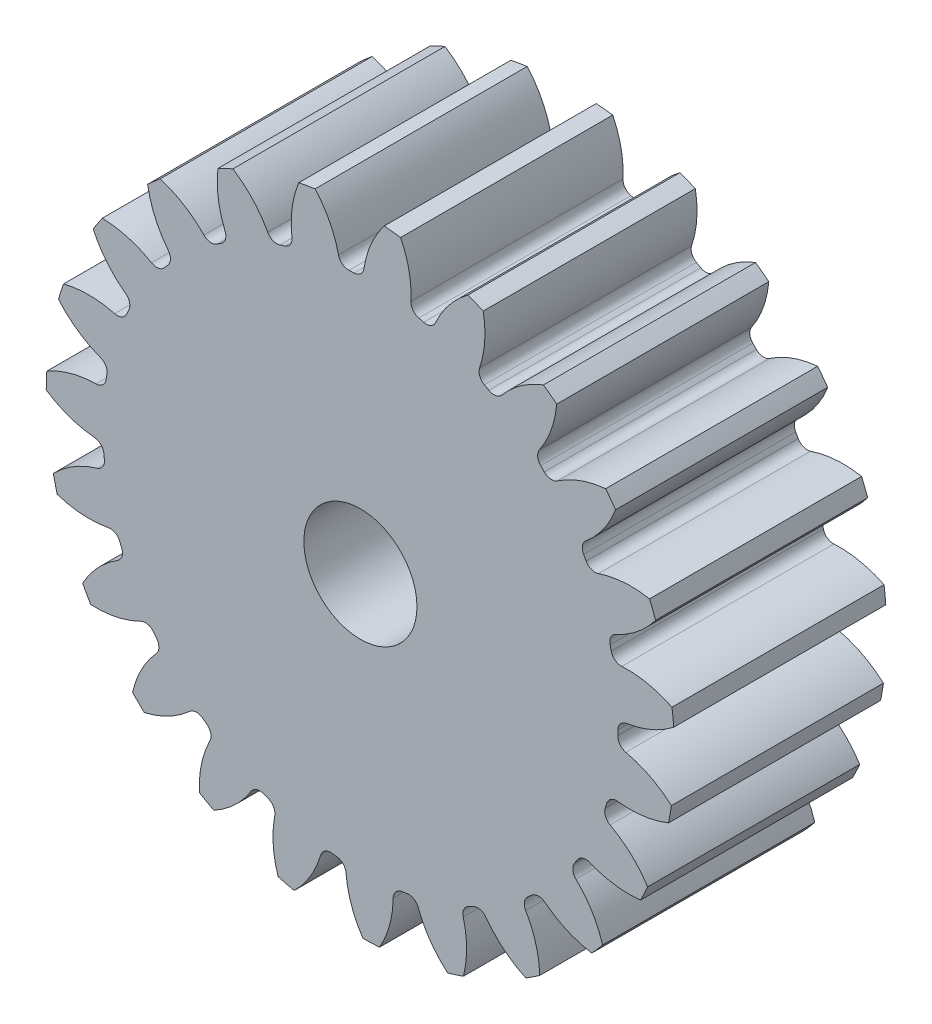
SolidWorks part; units mm, degrees
ref_plane "Front" through (0, 0, 0) normal (0, 0, 1) x (1, 0, 0)
ref_plane "Top" through (0, 0, 0) normal (0, 1, 0) x (1, 0, 0)
ref_plane "Right" through (0, 0, 0) normal (1, 0, 0) x (0, 0, -1)
sketch "Sketch3" plane through (0, 0, 0) normal (0, 0, 1) x (1, 0, 0)
  circle A0 centre (0, 0) radius 141.1111
  dimension "od" = 282.2222
extrude "gearBody" add sketch "Sketch3" along normal blind 95.25
sketch "Sketch2" plane through (0, 0, 0) normal (0, 0, 1) x (1, 0, 0)
  line L0 (0, 0) -> (112.7068, 46.6847) construction
  line L1 (140.0409, -20.591) -> (0, 0) construction
  line L2 (0, 0) -> (36.3143, 0) construction
  line L3 (129.7457, 4.4576) -> (129.1492, -13.2021) construction
  line L5 (129.4474, -4.3722) -> (0, 0) construction
  line L7 (0, 0) -> (121.993, 0) construction
  arc A0 (121.9749, 2.1028) -> (121.555, -10.3282) centre (0, 0) ccw construction
  arc A1 (140.6995, 10.7701) -> (139.6521, -20.2393) centre (0, 0) ccw construction
  arc A2 (129.7457, 4.4576) -> (129.1492, -13.2021) centre (0, 0) ccw construction
  arc A3 (115.6008, -5.0504) -> (115.6782, -2.7613) centre (0, 0) ccw
  arc A4 (140.0409, -20.591) -> (119.1928, -9.7357) centre (109.2999, -54.1832) ccw
  arc A5 (140.0409, -20.591) -> (141.1111, 11.0948) centre (0, 0) ccw
  arc A6 (141.1111, 11.0948) -> (119.5781, 1.671) centre (112.7068, 46.6847) cw
  arc A7 (115.6782, -2.7613) -> (119.5781, 1.671) centre (120.2714, -2.871) cw
  arc A8 (119.1928, -9.7357) -> (115.6008, -5.0504) centre (120.191, -5.2509) cw
  point P6 (141.1111, 11.0948)
  point P22 (140.0409, -20.591)
  dimension "baseDia" = 243.986
  dimension "od" = 282.2222
  dimension "pd" = 259.6444
  dimension "rd" = 231.4222
  dimension "rFillet" = 4.5946
  dimension "pointX" = 141.1111
  dimension "pointY" = 11.0948
  dimension "CTT" = 17.6597
  dimension "flankCenterAngle" = 22.5
extrude "toothCut" cut sketch "Sketch2" along normal through all
pattern_circular "CirPattern1" count 23 over 360 about axis through (0, 0, 0) along (0, 0, 1) of "toothCut"
sketch "hub1Dia" plane through (0, 0, 0) normal (0, 0, -1) x (-1, 0, 0)
  circle A0 centre (0, 0) radius 12.7
  dimension "hub1Dia" = 25.4
sketch "hub2Dia" plane through (0, 0, 95.25) normal (0, 0, 1) x (1, 0, 0)
  circle A0 centre (0, 0) radius 12.7
  dimension "hub2dia" = 25.4
sketch "boreDia" plane through (0, 0, 0) normal (0, 0, 1) x (1, 0, 0)
  circle A0 centre (0, 0) radius 25.4
  dimension "boreDia" = 50.8
extrude "bore" cut sketch "boreDia" against normal mid plane 25400
